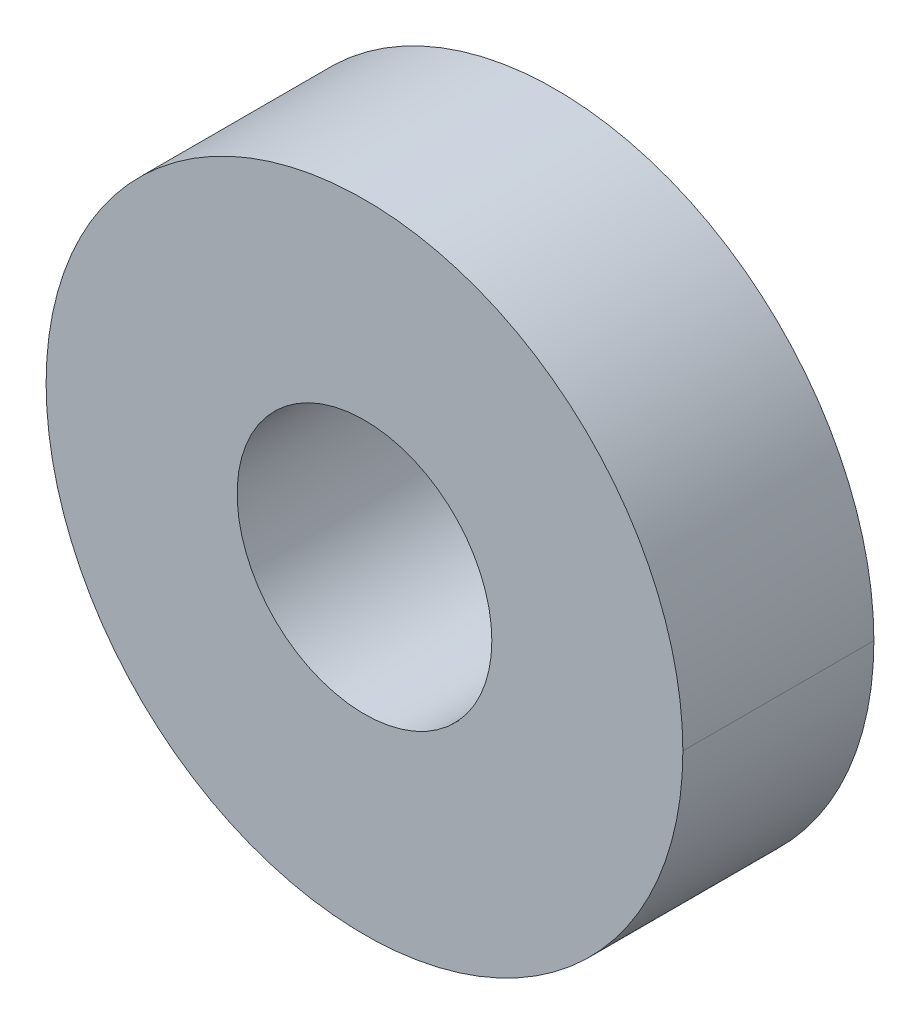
SolidWorks part; units mm, degrees
ref_plane "Front Plane" through (0, 0, 0) normal (0, 0, 1) x (1, 0, 0)
ref_plane "Top Plane" through (0, 0, 0) normal (0, 1, 0) x (1, 0, 0)
ref_plane "Right Plane" through (0, 0, 0) normal (1, 0, 0) x (0, 0, -1)
imported_body "Imported1"
sketch "Sketch1" plane through (0, 0, 3) normal (0, 0, 1) x (1, 0, 0)
  circle A0 centre (8.9312, 26.4578) radius 2
extrude "Cut-Extrude1" cut sketch "Sketch1" against normal blind 3
